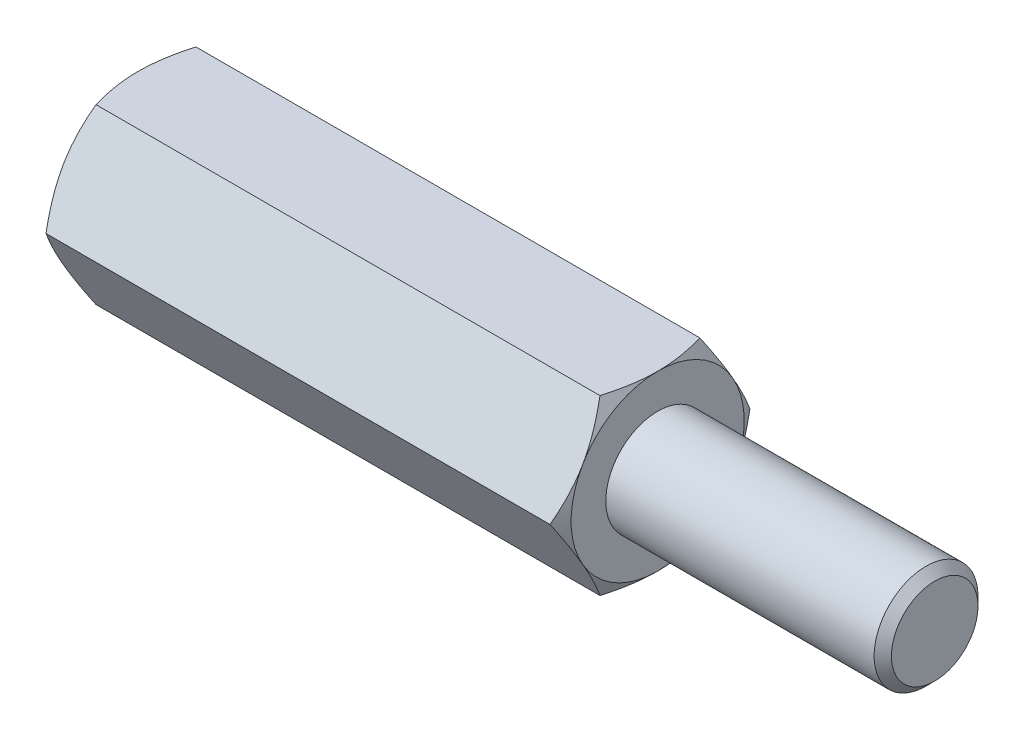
SolidWorks part; units mm, degrees
ref_plane "Front Plane" through (0, 0, 0) normal (0, 0, 1) x (1, 0, 0)
ref_plane "Top Plane" through (0, 0, 0) normal (0, 1, 0) x (1, 0, 0)
ref_plane "Right Plane" through (0, 0, 0) normal (1, 0, 0) x (0, 0, -1)
sketch "Sketch1" plane through (0, 0, 0) normal (1, 0, 0) x (0, 0, -1)
  line L1 (1.4434, 2.5) -> (-1.4434, 2.5)
  line L2 (-1.4434, 2.5) -> (-2.8868, 0)
  line L3 (-2.8868, 0) -> (-1.4434, -2.5)
  line L4 (-1.4434, -2.5) -> (1.4434, -2.5)
  line L5 (1.4434, -2.5) -> (2.8868, 0)
  line L6 (2.8868, 0) -> (1.4434, 2.5)
  circle A0 centre (0, 0) radius 2.5 construction
  dimension "D1" = 5
extrude "Extrude2" add sketch "Sketch1" along normal mid plane 15
sketch "Sketch2" plane through (0, 0, 0) normal (0, 0, 1) x (1, 0, 0)
  line L0 (-7.5, 2.5) -> (-6, 5.0981)
  line L1 (-7.5, 5.5) -> (-7.5, 2.5)
  line L3 (0, 0) -> (50000, 0) construction
  arc A0 (-6, 5.0981) -> (-7.5, 5.5) centre (-6.6962, 5.5) ccw
  dimension "D1" = 30
  dimension "D2" = 3
revolve "Cut-Revolve1" cut sketch "Sketch2" angle 360 about L3
mirror "Mirror1" about plane through (0, 0, 0) normal (1, 0, 0) of "Cut-Revolve1"
sketch "Sketch3" plane through (-7.5, 0, 0) normal (-1, 0, 0) x (0, 0, 1)
  circle A0 centre (0, 0) radius 1.25
  dimension "D1" = 2.5
extrude "Extrude3" cut sketch "Sketch3" against normal blind 8
sketch "Sketch4" plane through (0, 0, 0) normal (0, 0, 1) x (1, 0, 0)
  line L0 (0.5, 0) -> (0.5, 1.25)
  line L1 (7.2767, 0) -> (-7.2767, 0) construction
  line L2 (0.5, 1.25) -> (1.2217, 0)
  line L3 (1.2217, 0) -> (0.5, 0)
  line L4 (-7.5, 1.25) -> (-7.5, -1.25) construction
  point P4 (-7.5, 0)
  dimension "D1" = 30
  dimension "D2" = 1.25
  dimension "D3" = 8
revolve "Cut-Revolve2" cut sketch "Sketch4" angle 360 about L3
sketch "Sketch5" plane through (7.5, 0, 0) normal (1, 0, 0) x (0, 0, -1)
  circle A0 centre (0, 0) radius 1.5
  dimension "D1" = 3
extrude "Extrude4" add sketch "Sketch5" along normal blind 8
chamfer "Chamfer1" distance 0.25 angle 45 1 edges at (15.5, 0, -1.5)
equation "\"D2@Sketch4\" = \"D1@Sketch3\"/2"
